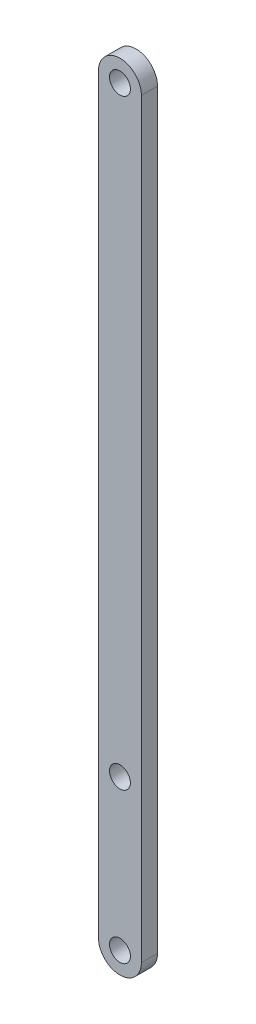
SolidWorks part; units mm, degrees
ref_plane "前视基准面" through (0, 0, 0) normal (0, 0, 1) x (1, 0, 0)
ref_plane "上视基准面" through (0, 0, 0) normal (0, 1, 0) x (1, 0, 0)
ref_plane "右视基准面" through (0, 0, 0) normal (1, 0, 0) x (0, 0, -1)
sketch "草图1" plane through (0, 0, 0) normal (0, 0, 1) x (1, 0, 0)
  line L0 (0, 0) -> (0, 140) construction
  line L1 (-4, 0) -> (-4, 140)
  line L2 (4, 0) -> (4, 140)
  arc A0 (-4, 0) -> (4, 0) centre (0, 0) ccw
  arc A1 (4, 140) -> (-4, 140) centre (0, 140) ccw
  point P3 (0, 70)
  dimension "D1" = 4
  dimension "D2" = 140
extrude "凸台-拉伸1" add sketch "草图1" along normal blind 3
hole_wizard "Ø3.9 (3.9) 直径孔1" positions "草图2" profile "草图3" hole size "Ø3.9" standard "GB"
sketch "草图2" plane through (0, 0, 3) normal (0, 0, 1) x (1, 0, 0)
  point P0 (0, 140)
  point P3 (0, 0)
sketch "草图3" plane through (0, 140, 3) normal (1, 0, 0) x (0, -1, 0)
  line L0 (0, 0) -> (0, 3)
  line L1 (0, 3) -> (1.95, 3)
  line L2 (1.95, 3) -> (1.95, 0)
  line L5 (1.95, 0) -> (0, 0)
  line L11 (0, -6.35) -> (0, 107.95) construction
  dimension "通孔孔直径" = 3.9
  dimension "通孔孔深度" = 3
hole_wizard "Ø3.9 (3.9) 直径孔2" positions "草图4" profile "草图5" hole size "Ø3.9" standard "GB"
sketch "草图4" plane through (0, 0, 3) normal (0, 0, 1) x (1, 0, 0)
  line L0 (0, 0) -> (0, 140) construction
  point P7 (0, 28)
  dimension "D1" = 28
sketch "草图5" plane through (0, 28, 3) normal (1, 0, 0) x (0, -1, 0)
  line L0 (0, 0) -> (0, 3)
  line L1 (0, 3) -> (1.95, 3)
  line L2 (1.95, 3) -> (1.95, 0)
  line L5 (1.95, 0) -> (0, 0)
  line L11 (0, -6.35) -> (0, 107.95) construction
  dimension "通孔孔直径" = 3.9
  dimension "通孔孔深度" = 3
